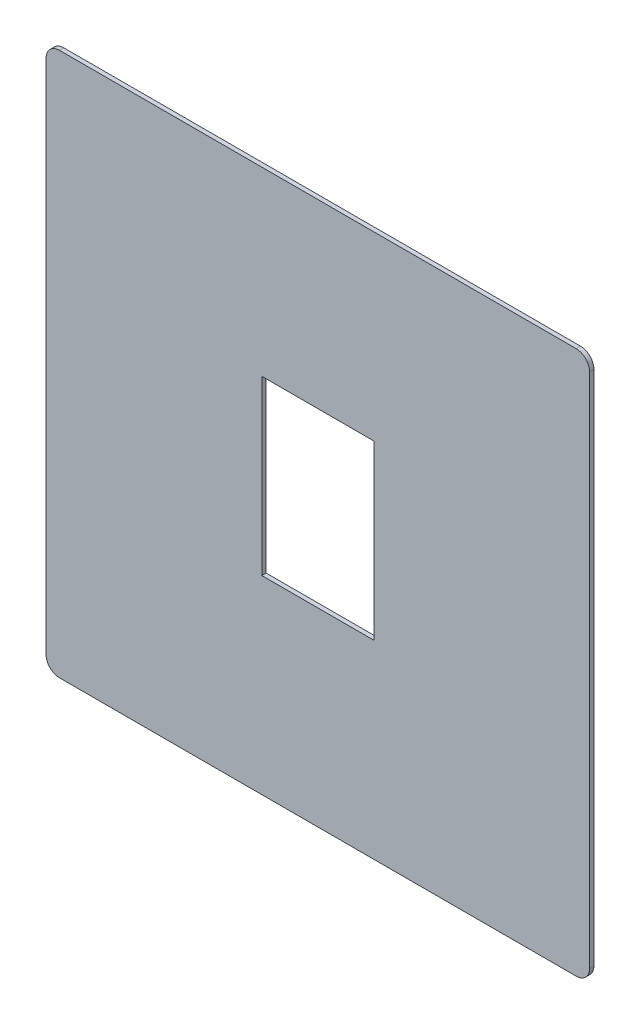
SolidWorks part; units mm, degrees
ref_plane "Plan1" through (0, 0, 0) normal (0, 0, 1) x (1, 0, 0)
ref_plane "Plan2" through (0, 0, 0) normal (0, 1, 0) x (1, 0, 0)
ref_plane "Plan3" through (0, 0, 0) normal (1, 0, 0) x (0, 0, -1)
sketch "Esquisse1" plane through (0, 0, 0) normal (0, 0, 1) x (1, 0, 0)
  line L0 (29.9497, 31) -> (-29.9497, 31)
  line L1 (31.5, -30.4497) -> (31.5, 29.4497)
  line L2 (-29.9497, -32) -> (29.9497, -32)
  line L3 (-31.5, 29.4497) -> (-31.5, -30.4497)
  line L5 (32.5, -30.4497) -> (32.5, 29.4497) construction
  line L6 (-6.5, 10) -> (-6.5, -10) construction
  line L7 (-6.5, -10) -> (6.5, -10) construction
  line L8 (6.5, -10) -> (6.5, 10) construction
  line L9 (6.5, 10) -> (-6.5, 10) construction
  line L10 (-6.5, 10) -> (-6.5, -10)
  line L11 (-6.5, -10) -> (6.5, -10)
  line L12 (6.5, -10) -> (6.5, 10)
  line L13 (6.5, 10) -> (-6.5, 10)
  arc A0 (31.5, 29.4497) -> (29.9497, 31) centre (29.9497, 29.4497) ccw
  arc A1 (29.9497, -32) -> (31.5, -30.4497) centre (29.9497, -30.4497) ccw
  arc A2 (-31.5, -30.4497) -> (-29.9497, -32) centre (-29.9497, -30.4497) ccw
  arc A3 (-29.9497, 31) -> (-31.5, 29.4497) centre (-29.9497, 29.4497) ccw
  arc A5 (32.5, 29.4497) -> (29.9497, 32) centre (29.9497, 29.4497) ccw construction
  arc A6 (-29.9497, 32) -> (-32.5, 29.4497) centre (-29.9497, 29.4497) ccw construction
  arc A7 (-32.5, -30.4497) -> (-29.9497, -33) centre (-29.9497, -30.4497) ccw construction
  arc A8 (29.9497, -33) -> (32.5, -30.4497) centre (29.9497, -30.4497) ccw construction
  dimension "D1" = 1
extrude "Base-Extrusion" add sketch "Esquisse1" along normal blind 0.5
